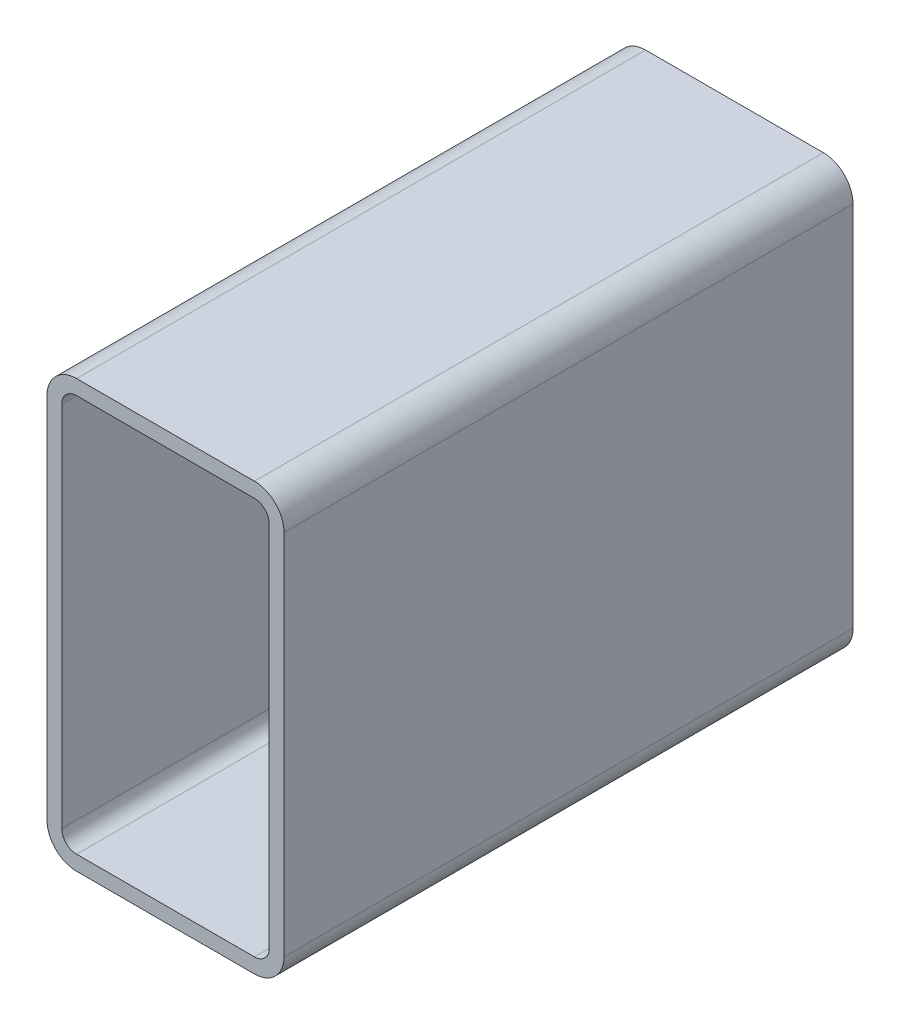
SolidWorks part; units mm, degrees
ref_plane "Front Plane" through (0, 0, 0) normal (0, 0, 1) x (1, 0, 0)
ref_plane "Top Plane" through (0, 0, 0) normal (0, 1, 0) x (1, 0, 0)
ref_plane "Right Plane" through (0, 0, 0) normal (1, 0, 0) x (0, 0, -1)
sketch "Sketch1" plane through (0, 0, 0) normal (0, 0, 1) x (1, 0, 0)
sketch_block_instance "HSS9x5x0.3125-1"
sketch_block "HSS9x5x0.3125"
extrude "Boss-Extrude1" add sketch "Sketch1" along normal blind 304.8
